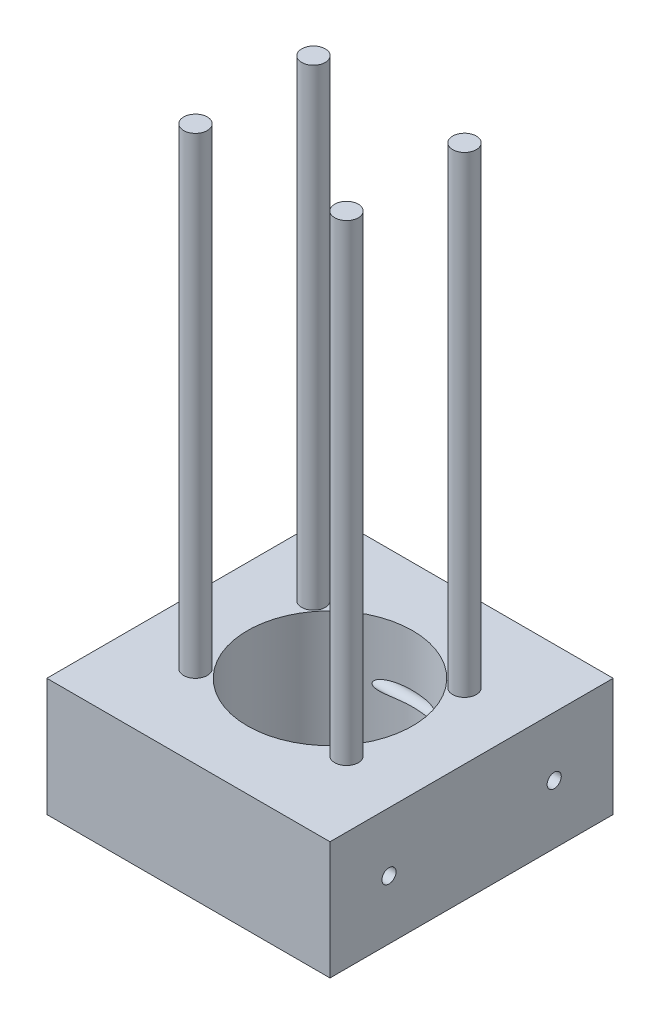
SolidWorks part; units mm, degrees
ref_plane "Face" through (0, 0, 0) normal (0, 0, 1) x (1, 0, 0)
ref_plane "Dessus" through (0, 0, 0) normal (0, 1, 0) x (1, 0, 0)
ref_plane "Droite" through (0, 0, 0) normal (1, 0, 0) x (0, 0, -1)
sketch "Esquisse1" plane through (0, 0, 0) normal (0, 0, 1) x (1, 0, 0)
  line L1 (0, 0) -> (120, 0)
  line L2 (0, 0) -> (0, 50)
  line L3 (0, 50) -> (120, 50)
  line L4 (120, 0) -> (120, 50)
  dimension "D1" = 120
  dimension "D2" = 50
extrude "Base-Extrusion" add sketch "Esquisse1" along normal blind 120
sketch "Esquisse2" plane through (0, 50, 0) normal (0, 1, 0) x (-1, 0, 0)
  line L0 (0, 0) -> (-120, 120) construction
  circle A0 centre (-60, 60) radius 35
  dimension "D1" = 70
extrude "Enlèv. mat.-Extru.1" cut sketch "Esquisse2" against normal through all
sketch "Esquisse3" plane through (0, 0, 0) normal (-1, 0, 0) x (0, 0, 1)
  line L0 (0, 25) -> (120, 25) construction
  line L1 (0, 50) -> (0, 0) construction
  line L2 (120, 50) -> (120, 0) construction
  line L3 (60, 50) -> (60, 0) construction
  line L4 (120, 50) -> (0, 50) construction
  line L5 (120, 0) -> (0, 0) construction
  circle A0 centre (95, 25) radius 10
  circle A1 centre (25, 25) radius 10
  dimension "D1" = 70
  dimension "D2" = 20
extrude "Enlèv. mat.-Extru.2" cut sketch "Esquisse3" against normal blind 8
sketch "Esquisse4" plane through (8, 0, 0) normal (-1, 0, 0) x (0, 0, 1)
  circle A0 centre (25, 25) radius 3
  circle A1 centre (95, 25) radius 3
  circle A2 centre (95, 25) radius 10 construction
  circle A3 centre (25, 25) radius 10 construction
  dimension "D1" = 6
extrude "Enlèv. mat.-Extru.3" cut sketch "Esquisse4" against normal through all
sketch "Esquisse5" plane through (0, 50, 0) normal (0, 1, 0) x (-1, 0, 0)
  line L0 (-120, 60) -> (0, 60) construction
  line L1 (-120, 120) -> (-120, 0) construction
  line L2 (-60, 0) -> (-60, 120) construction
  line L3 (-120, 0) -> (0, 0) construction
  line L4 (-120, 120) -> (0, 120) construction
  circle A0 centre (-92, 35) radius 5
  circle A1 centre (-92, 85) radius 5
  circle A2 centre (-28, 35) radius 5
  circle A3 centre (-28, 85) radius 5
  dimension "D1" = 10
  dimension "D2" = 50
  dimension "D5" = 32
  dimension "D4" = 50
  dimension "D3" = 32
extrude "Boss.-Extru.1" add sketch "Esquisse5" along normal blind 200
